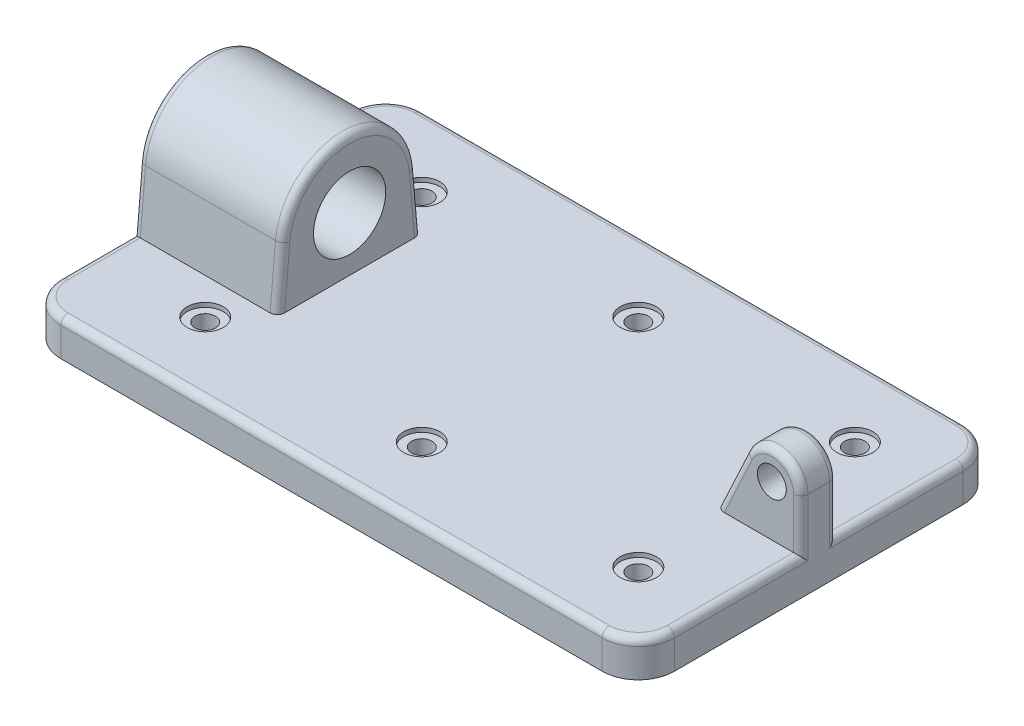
SolidWorks part; units mm, degrees
ref_plane "Front" through (0, 0, 0) normal (0, 0, 1) x (1, 0, 0)
ref_plane "Top" through (0, 0, 0) normal (0, 1, 0) x (1, 0, 0)
ref_plane "Right" through (0, 0, 0) normal (1, 0, 0) x (0, 0, -1)
sketch "Sketch1" plane through (0, 0, 0) normal (0, 0, 1) x (1, 0, 0)
  line L0 (0, 0) -> (107.95, 0)
  line L1 (0, 0) -> (0, 6.35)
  line L2 (107.95, 6.35) -> (0, 6.35)
  line L3 (107.95, 6.35) -> (107.95, 0)
  dimension "D1" = 107.95
  dimension "D2" = 6.35
extrude "Base-Extrude" add sketch "Sketch1" along normal mid plane 63.5
sketch "Sketch2" plane through (0, 0, 0) normal (0, 0, 1) x (1, 0, 0)
  line L0 (107.95, 6.35) -> (107.95, 15.24)
  line L1 (98.266, 17.3869) -> (93.1194, 6.35)
  line L2 (107.95, 6.35) -> (0, 6.35) construction
  line L3 (93.1194, 6.35) -> (107.95, 6.35)
  line L4 (0, 0) -> (107.95, 0) construction
  arc A0 (107.95, 15.24) -> (98.266, 17.3869) centre (102.87, 15.24) ccw
  dimension "D1" = 5.08
  dimension "D2" = 15.24
  dimension "D3" = 65
extrude "lever boss" add sketch "Sketch2" along normal mid plane 6.35
sketch "Sketch3" plane through (0, 0, 0) normal (-1, 0, 0) x (0, 0, 1)
  line L0 (0, 0) -> (0, 31.6598) construction
  line L1 (12.7, 6.35) -> (11.7765, 16.9053)
  line L2 (31.75, 6.35) -> (-31.75, 6.35) construction
  line L3 (-12.7, 6.35) -> (-11.7765, 16.9053)
  line L4 (-12.7, 6.35) -> (12.7, 6.35)
  arc A0 (-11.7765, 16.9053) -> (11.7765, 16.9053) centre (0, 15.875) cw
  dimension "D2" = 9.525
  dimension "D1" = 25.4
  dimension "D3" = 85
extrude "Boss-Extrude2" add sketch "Sketch3" against normal blind 25.4
fillet "Fillet1" radius 6.35 5 edges at (107.95, 3.175, 31.75) (0, 3.175, 31.75) (107.95, 3.175, -31.75) (0, 3.175, -31.75)
hole_wizard "Hole1" positions "Sketch5" profile "Sketch4" legacy
sketch "Sketch5" plane through (0, 0, 3.175) normal (0, 0, 1) x (1, 0, 0)
  arc A0 (107.95, 15.24) -> (98.266, 17.3869) centre (102.87, 15.24) ccw construction
  point P0 (102.87, 15.24)
sketch "Sketch4" plane through (102.87, 15.24, 3.175) normal (1, 0, 0) x (0, -1, 0)
  line L0 (0, 0) -> (0, 34.925)
  line L1 (0, 34.925) -> (2.54, 34.925)
  line L2 (2.54, 34.925) -> (2.54, 0)
  line L3 (2.54, 0) -> (0, 0)
  line L4 (0, 110) -> (0, -10) construction
  dimension "Diameter" = 5.08
  dimension "Depth" = 34.925
hole_wizard "Hole2" positions "Sketch6" profile "Sketch7" legacy
sketch "Sketch6" plane through (25.4, 3.19, 95.1751) normal (1, 0, 0) x (0, 0, -1)
  arc A1 (106.9516, 13.7153) -> (83.3985, 13.7153) centre (95.1751, 12.685) ccw construction
  point P0 (95.1751, 12.685)
sketch "Sketch7" plane through (25.4, 15.875, 0) normal (0, 1, 0) x (0, 0, -1)
  line L0 (0, 0) -> (0, 25.4)
  line L1 (0, 25.4) -> (6.35, 25.4)
  line L2 (6.35, 25.4) -> (6.35, 0)
  line L3 (6.35, 0) -> (0, 0)
  line L4 (0, 110) -> (0, -10) construction
  dimension "Diameter" = 12.7
  dimension "Depth" = 25.4
sketch "Sketch8" plane through (72.2885, 6.35, 6.6308) normal (0, 1, 0) x (-1, 0, 0)
  line L0 (-29.3115, 25.1192) -> (65.9385, 25.1192) construction
  line L1 (-35.6615, 18.7692) -> (-35.6615, -3.4558) construction
  point P0 (-22.9615, 12.4192)
  dimension "D1" = 12.7
  dimension "D2" = 12.7
sketch "Sketch9" plane through (95.25, 6.35, 19.05) normal (1, 0, 0) x (0, 0, 1)
  line L0 (0, 0) -> (0, 6.35)
  line L1 (0, 6.35) -> (1.8034, 6.35)
  line L2 (1.8034, 6.35) -> (1.8034, 0.762)
  line L3 (1.8034, 0.762) -> (3.175, 0.762)
  line L4 (3.175, 0.762) -> (3.175, 0)
  line L5 (3.175, 0) -> (0, 0)
  line L6 (0, 110) -> (0, -10) construction
  dimension "Diameter" = 3.6068
  dimension "Depth" = 6.35
  dimension "C-Bore Diameter" = 6.35
  dimension "C-Bore Depth" = 0.762
hole_wizard "#4 spotface hole1" positions "Sketch8" profile "Sketch9" legacy
pattern_linear "LPattern1" count 3 spacing 38.1 along (-1, 0, 0) count 2 spacing 38.1 along (0, 0, -1) of "#4 spotface hole1"
fillet "Fillet2" radius 1.27 24 edges at (103.9695, 20.1996, -3.175) (95.6927, 11.8685, -3.175) (103.9695, 20.1996, 3.175) (95.6927, 11.8685, 3.175) (0, 6.35, -19.05) (0, 11.6277, -12.2383) (0, 27.6965, 0) (25.4, 11.6277, 12.2383) (25.4, 11.6277, -12.2383) (25.4, 27.6965, 0) (0, 11.6277, 12.2383) (53.975, 6.35, -31.75) (0, 6.35, 19.05) (53.975, 6.35, 31.75) (106.0901, 6.35, -29.8901) (106.0901, 6.35, 29.8901) (1.8599, 6.35, 29.8901) (1.8599, 6.35, -29.8901)
